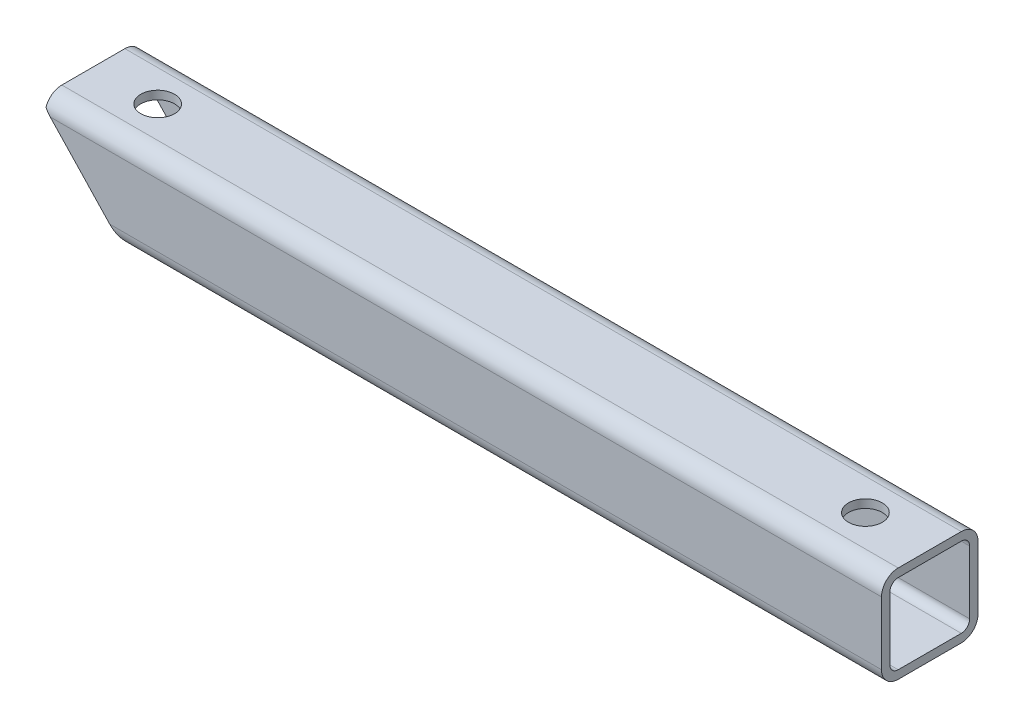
SolidWorks part; units mm, degrees
ref_plane "Plan de face" through (0, 0, 0) normal (0, 0, 1) x (1, 0, 0)
ref_plane "Plan de dessus" through (0, 0, 0) normal (0, 1, 0) x (1, 0, 0)
ref_plane "Plan de droite" through (0, 0, 0) normal (1, 0, 0) x (0, 0, -1)
sketch "Esquisse1" plane through (0, 0, 0) normal (0, 0, 1) x (1, 0, 0)
  line L0 (-130, 0) -> (130, 0)
  dimension "D1" = 260
other "Elément mécano-soudé1"
ref_plane "Plan1" through (-130, 0, 0) normal (1, 0, 0) x (0, 0, -1)
sketch "Sketch1" plane through (-130, 0, 0) normal (1, 0, 0) x (0, 0, -1)
  line L0 (-9.8, -12.4) -> (9.8, -12.4)
  line L1 (-12.4, -9.8) -> (-12.4, 9.8)
  line L2 (9.8, 12.4) -> (-9.8, 12.4)
  line L3 (12.4, 9.8) -> (12.4, -9.8)
  line L4 (-9.8, -15) -> (9.8, -15)
  line L5 (-15, -9.8) -> (-15, 9.8)
  line L6 (9.8, 15) -> (-9.8, 15)
  line L7 (15, 9.8) -> (15, -9.8)
  arc A0 (15, 9.8) -> (9.8, 15) centre (9.8, 9.8) ccw
  arc A1 (9.8, -15) -> (15, -9.8) centre (9.8, -9.8) ccw
  arc A2 (-15, -9.8) -> (-9.8, -15) centre (-9.8, -9.8) ccw
  arc A3 (-9.8, 15) -> (-15, 9.8) centre (-9.8, 9.8) ccw
  arc A4 (-9.8, 12.4) -> (-12.4, 9.8) centre (-9.8, 9.8) ccw
  arc A5 (12.4, 9.8) -> (9.8, 12.4) centre (9.8, 9.8) ccw
  arc A6 (9.8, -12.4) -> (12.4, -9.8) centre (9.8, -9.8) ccw
  arc A7 (-12.4, -9.8) -> (-9.8, -12.4) centre (-9.8, -9.8) ccw
  point P0 (-15, 0)
  point P1 (15, 0)
  point P2 (0, 15)
  point P3 (0, -15)
  point P4 (0, 0)
  point P5 (-15, -15)
  point P6 (15, -15)
  point P7 (15, 15)
  point P8 (-15, 15)
  point P33 (0, 0)
  dimension "D1" = 5.2
  dimension "Thickness" = 2.6
  dimension "V_leg" = 30
sketch "Esquisse3" plane through (0, 15, 0) normal (0, 1, 0) x (-1, 0, 0)
  line L0 (130, 0) -> (-130, 0) construction
  line L1 (-130, -9.8) -> (-130, 9.8) construction
  circle A0 centre (-110, 0) radius 5.25
  circle A1 centre (110, 0) radius 5.25
  dimension "D1" = 10.5
  dimension "D3" = 220
  dimension "D2" = 20
extrude "Enlèv. mat.-Extru.1" cut sketch "Esquisse3" against normal through all
sketch "Esquisse4" plane through (0, 0, -15) normal (0, 0, -1) x (-1, 0, 0)
  line L0 (130, 11.5) -> (105, -15)
  line L1 (-130, -15) -> (130, -15) construction
  line L2 (105, -15) -> (130, -15)
  line L3 (130, -15) -> (130, 11.5)
  dimension "D1" = 25
  dimension "D2" = 26.5
extrude "Enlèv. mat.-Extru.2" cut sketch "Esquisse4" against normal through all
